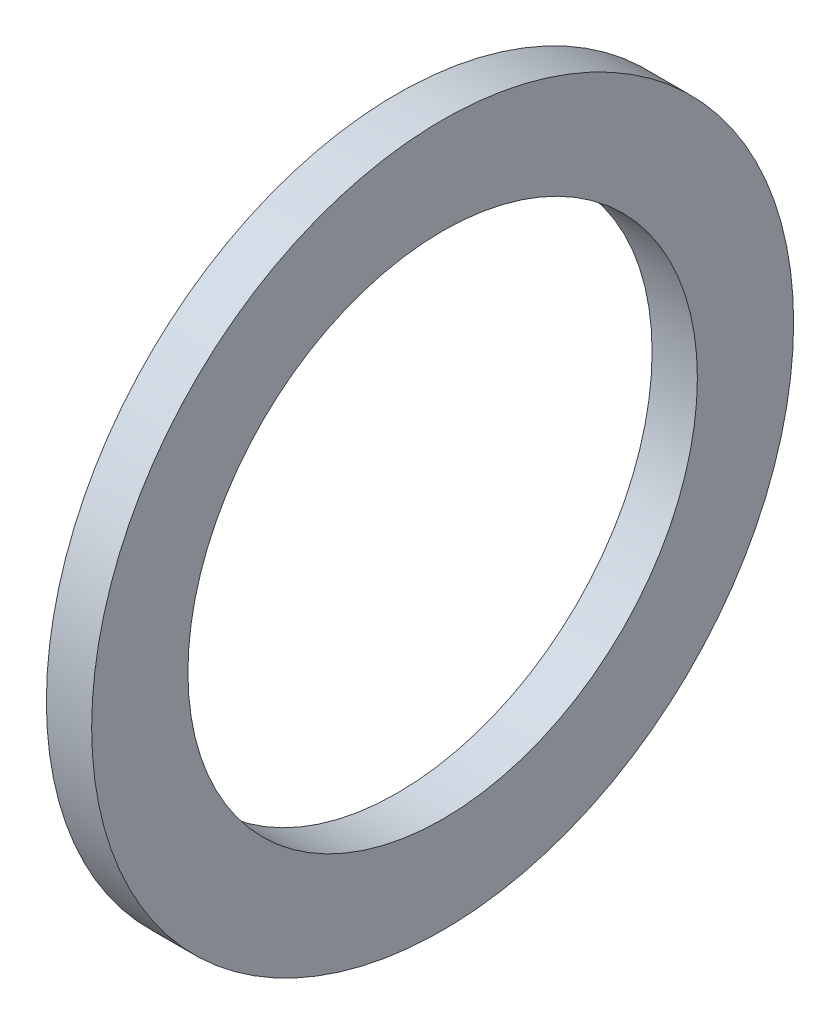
SolidWorks part; units mm, degrees
ref_plane "frontal" through (0, 0, 0) normal (0, 0, 1) x (1, 0, 0)
ref_plane "horizontal" through (0, 0, 0) normal (0, 1, 0) x (1, 0, 0)
ref_plane "profil" through (0, 0, 0) normal (1, 0, 0) x (0, 0, -1)
sketch "Esquisse1" plane through (0, 0, 0) normal (1, 0, 0) x (0, 0, -1)
  circle A0 centre (0, 0) radius 15.5
  circle A1 centre (0, 0) radius 11.25
  dimension "D1" = 22.5
  dimension "D2" = 31
extrude "Base-Extrusion" add sketch "Esquisse1" along normal blind 2
